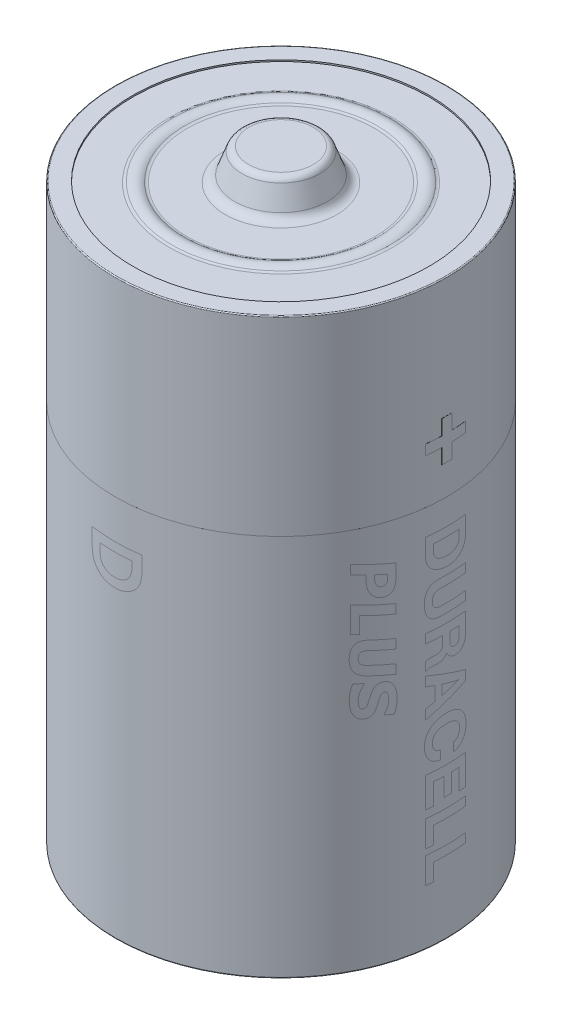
SolidWorks part; units mm, degrees
ref_plane "Front Plane" through (0, 0, 0) normal (0, 0, 1) x (1, 0, 0)
ref_plane "Top Plane" through (0, 0, 0) normal (0, 1, 0) x (1, 0, 0)
ref_plane "Right Plane" through (0, 0, 0) normal (1, 0, 0) x (0, 0, -1)
sketch "Sketch1" plane through (0, 0, 0) normal (1, 0, 0) x (0, 0, -1)
  line L0 (0, 0) -> (0, 60.3) construction
  line L1 (-16.5, 57.2) -> (-16.5, 38.3001)
  line L2 (0, 1) -> (-1.3268, 1)
  line L3 (-1.5866, 0.85) -> (-1.8175, 0.45)
  line L4 (-2.2506, 0.2) -> (-2.7619, 0.2)
  line L5 (-16.4, 0.2) -> (-13.5, 0.2)
  line L6 (-13.5, 0.2) -> (-13.5, 0.25)
  line L7 (-13.5, 0.25) -> (-12.5, 0.25)
  line L8 (-12.5, 0.25) -> (-12.5, 0.35)
  line L9 (-12.5, 0.35) -> (-9.6948, 0.35)
  line L10 (-7.5552, 0.35) -> (-5.0333, 0.35)
  line L11 (-16.4, 57.3) -> (-14.75, 57.3)
  line L12 (-14.75, 57.3) -> (-14.75, 57.15)
  line L13 (-14.75, 57.15) -> (-11.1587, 57.15)
  line L14 (-9.3413, 57.15) -> (-5.5467, 57.15)
  line L15 (-4.607, 57.808) -> (-3.8676, 59.8394)
  line L16 (-3.2099, 60.3) -> (0, 60.3)
  line L17 (0, 1) -> (0, 60.3)
  line L18 (-16.5, 38.3) -> (-15.5, 38.3)
  line L19 (-15.5, 38.3) -> (-15.5, 38.3001)
  line L20 (-16.5, 38.3001) -> (-15.5, 38.3001)
  line L21 (-16.5, 38.3) -> (-16.5, 0.3)
  arc A0 (-9.3801, 0.2386) -> (-7.8699, 0.2386) centre (-8.625, 1.1712) ccw
  arc A1 (-4.9675, 0.3457) -> (-2.7619, 0.2) centre (-2.7619, 16.9723) ccw
  arc A2 (-1.3268, 1) -> (-1.5866, 0.85) centre (-1.3268, 0.7) ccw
  arc A3 (-1.8175, 0.45) -> (-2.2506, 0.2) centre (-2.2506, 0.7) cw
  arc A4 (-5.0333, 0.35) -> (-4.9675, 0.3457) centre (-5.0333, -0.15) cw
  arc A5 (-9.6948, 0.35) -> (-9.3801, 0.2386) centre (-9.6948, -0.15) cw
  arc A6 (-7.5552, 0.35) -> (-7.8699, 0.2386) centre (-7.5552, -0.15) ccw
  arc A7 (-16.5, 0.3) -> (-16.4, 0.2) centre (-16.4, 0.3) ccw
  arc A8 (-9.6086, 57.2274) -> (-10.8914, 57.2274) centre (-10.25, 56.2133) ccw
  arc A9 (-3.8676, 59.8394) -> (-3.2099, 60.3) centre (-3.2099, 59.6) cw
  arc A10 (-5.5467, 57.15) -> (-4.607, 57.808) centre (-5.5467, 58.15) ccw
  arc A11 (-16.5, 57.2) -> (-16.4, 57.3) centre (-16.4, 57.2) cw
  arc A12 (-9.3413, 57.15) -> (-9.6086, 57.2274) centre (-9.3413, 57.65) cw
  arc A13 (-11.1587, 57.15) -> (-10.8914, 57.2274) centre (-11.1587, 57.65) ccw
  point P20 (-1.5, 1)
  point P23 (-1.9619, 0.2)
  point P26 (-5, 0.35)
  point P29 (-9.5, 0.35)
  point P32 (-7.75, 0.35)
  point P35 (-16.5, 0.2)
  point P45 (-3.7, 60.3)
  point P50 (-16.5, 57.3)
  point P53 (-9.5, 57.15)
  point P56 (-11, 57.15)
  dimension "D7" = 2.4
  dimension "D16" = 0.3
  dimension "D17" = 0.5
  dimension "D18" = 0.5
  dimension "D19" = 0.5
  dimension "D20" = 0.1
  dimension "D26" = 2.4
  dimension "D30" = 0.7
  dimension "D31" = 1
  dimension "D32" = 0.1
  dimension "D33" = 0.5
  dimension "D1" = 16.5
  dimension "D2" = 3
  dimension "D3" = 0.05
  dimension "D4" = 0.15
  dimension "D5" = 1
  dimension "D6" = 3
  dimension "D8" = 1.75
  dimension "D9" = 1
  dimension "D10" = 1.5
  dimension "D11" = 60
  dimension "D12" = 5
  dimension "D13" = 0.2
  dimension "D14" = 0.2
  dimension "D15" = 0.8
  dimension "D21" = 57
  dimension "D22" = 1.75
  dimension "D23" = 0.15
  dimension "D24" = 10.25
  dimension "D25" = 1.5
  dimension "D27" = 70
  dimension "D28" = 60.3
  dimension "D29" = 3.7
  dimension "D34" = 1
  dimension "D35" = 19
  dimension "D36" = 0.0001
revolve "Revolve1" add sketch "Sketch1" angle 360 about L0
ref_plane "Plane1" through (18, 0, 0) normal (1, 0, 0) x (0, 0, -1)
ref_plane "Plane2" through (0, 0, 18) normal (0, 0, 1) x (1, 0, 0)
sketch "Sketch2" plane through (18, 0, 0) normal (1, 0, 0) x (0, 0, -1)
  line L0 (-2, 36) -> (-2, 4) construction
  text T0 "DURACELL" font "Basic Sans SF" height 4
  dimension "D1" = 4
  dimension "D2" = 32
  dimension "D3" = 2
wrap "Wrap1" sketch "Sketch2" wrap type scribe source sketch "Sketch2"
sketch "Sketch3" plane through (18, 0, 0) normal (1, 0, 0) x (0, 0, -1)
  line L0 (-8, 35.5) -> (-8, 23.5) construction
  text T0 "PLUS" font "Verdana" height 3.5
  dimension "D1" = 12
  dimension "D2" = 23.5
  dimension "D3" = 8
wrap "Wrap2" sketch "Sketch3" wrap type scribe source sketch "Sketch3"
sketch "Sketch4" plane through (0, 0, 18) normal (0, 0, 1) x (1, 0, 0)
  line L0 (-2.5, 35) -> (-2.5, 27) construction
  text T0 "D" font "Century Gothic" height 5
  dimension "D1" = 2.5
  dimension "D2" = 8
  dimension "D3" = 27
wrap "Wrap3" sketch "Sketch4" wrap type scribe source sketch "Sketch4"
sketch "Sketch5" plane through (18, 0, 0) normal (1, 0, 0) x (0, 0, -1)
  line L0 (0.5, 43.8) -> (2, 43.8)
  line L1 (-0.5, 45.3) -> (0.5, 45.3)
  line L2 (-0.5, 45.3) -> (-0.5, 43.8)
  line L3 (-0.5, 41.3) -> (0.5, 41.3)
  line L4 (0.5, 45.3) -> (0.5, 43.8)
  line L5 (-2, 43.8) -> (-0.5, 43.8)
  line L6 (-2, 43.8) -> (-2, 42.8)
  line L7 (-2, 42.8) -> (-0.5, 42.8)
  line L8 (2, 43.8) -> (2, 42.8)
  line L9 (-0.5, 42.8) -> (-0.5, 41.3)
  line L10 (0.5, 42.8) -> (2, 42.8)
  line L11 (0.5, 42.8) -> (0.5, 41.3)
  line L12 (16.5, 38.3) -> (-16.5, 38.3) construction
  dimension "D1" = 1
  dimension "D2" = 1
  dimension "D3" = 4
  dimension "D4" = 4
  dimension "D5" = 1.5
  dimension "D6" = 1.5
  dimension "D7" = 0.5
  dimension "D8" = 3
wrap "Wrap4" sketch "Sketch5" wrap type emboss source sketch "Sketch5" thickness 0.01 parameters "D1"=0.01
